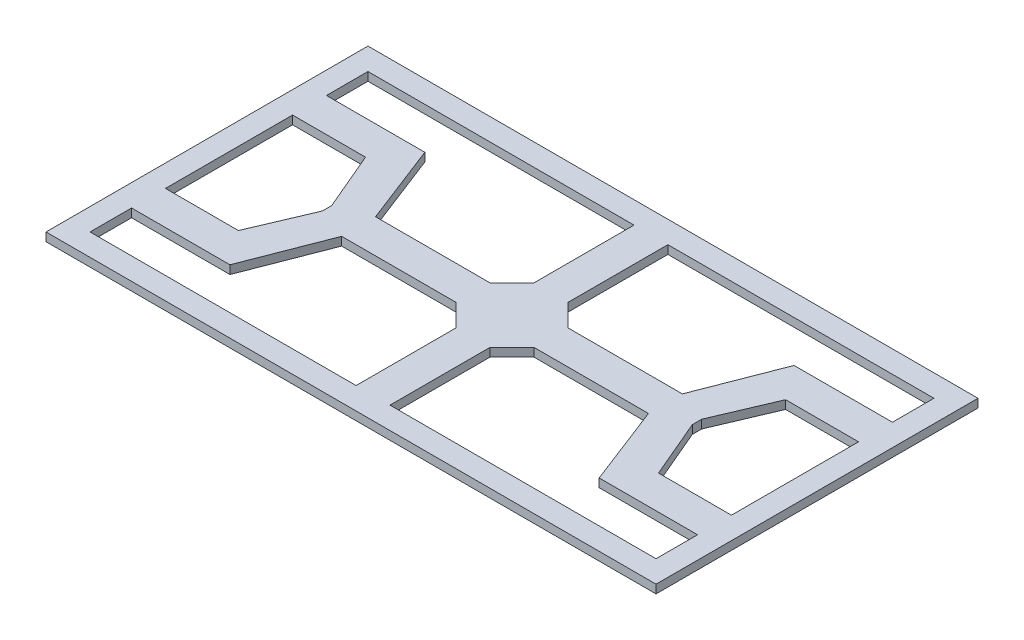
SolidWorks part; units mm, degrees
ref_plane "Front Plane" through (0, 0, 0) normal (0, 0, 1) x (1, 0, 0)
ref_plane "Top Plane" through (0, 0, 0) normal (0, 1, 0) x (1, 0, 0)
ref_plane "Right Plane" through (0, 0, 0) normal (1, 0, 0) x (0, 0, -1)
sketch "Sketch2" plane through (0, 0, 0) normal (0, 1, 0) x (1, 0, 0)
  line L0 (0, 241.3) -> (0, -49758.7) construction
  line L1 (-457.2, -241.3) -> (457.2, -241.3) construction
  line L2 (-457.2, -241.3) -> (-457.2, 241.3) construction
  line L3 (-457.2, 241.3) -> (457.2, 241.3) construction
  line L4 (457.2, -241.3) -> (457.2, 241.3) construction
  line L5 (-457.2, -241.3) -> (457.2, 241.3) construction
  line L6 (-457.2, 241.3) -> (457.2, -241.3) construction
  line L7 (-25.4, 58.1987) -> (-58.1987, 25.4)
  line L8 (-58.1987, -25.4) -> (-25.4, -58.1987)
  line L9 (25.4, -58.1987) -> (58.1987, -25.4)
  line L10 (58.1987, 25.4) -> (25.4, 58.1987)
  line L11 (0, 0) -> (50000, 0) construction
  line L13 (25.4, 208.28) -> (25.4, 58.1987)
  line L14 (-25.4, 208.28) -> (-25.4, 58.1987)
  line L15 (-25.4, -208.28) -> (-25.4, -58.1987)
  line L16 (25.4, -208.28) -> (25.4, -58.1987)
  line L18 (-424.18, -95.25) -> (-424.18, 95.25)
  line L20 (-424.18, 146.05) -> (-276.7263, 146.05)
  line L21 (-424.18, 95.25) -> (-314.8263, 95.25)
  line L22 (-229.9486, -25.4) -> (-229.9486, 25.4) construction
  line L23 (-276.7263, 146.05) -> (-229.9486, 25.4)
  line L24 (-229.9486, 25.4) -> (-277.3132, 7.0361) construction
  line L26 (-314.8263, 95.25) -> (-277.3132, 7.0361)
  line L28 (-229.9486, 25.4) -> (-58.1987, 25.4)
  line L29 (-277.3132, -7.0361) -> (-277.3132, 7.0361) construction
  line L30 (-277.3132, -7.0361) -> (-277.3132, 7.0361)
  line L31 (-229.9486, -25.4) -> (-58.1987, -25.4)
  line L32 (-229.9486, -25.4) -> (-277.3132, -7.0361) construction
  line L68 (-457.2, -241.3) -> (-457.2, 241.3)
  line L69 (-424.18, 146.05) -> (-424.18, 208.28)
  line L70 (-424.18, 208.28) -> (-25.4, 208.28)
  line L71 (-457.2, 241.3) -> (457.2, 241.3)
  line L72 (-424.18, -146.05) -> (-424.18, -208.28)
  line L73 (-424.18, -146.05) -> (-276.7263, -146.05)
  line L74 (-457.2, -241.3) -> (457.2, -241.3)
  line L75 (-424.18, -208.28) -> (-25.4, -208.28)
  line L78 (-276.7263, -146.05) -> (-229.9486, -25.4)
  line L80 (-314.8263, -95.25) -> (-277.3132, -7.0361)
  line L81 (-424.18, -95.25) -> (-314.8263, -95.25)
  line L82 (277.3132, -7.0361) -> (277.3132, 7.0361)
  line L85 (424.18, -208.28) -> (25.4, -208.28)
  line L86 (424.18, -146.05) -> (424.18, -208.28)
  line L87 (424.18, -146.05) -> (276.7263, -146.05)
  line L88 (276.7263, -146.05) -> (229.9486, -25.4)
  line L89 (229.9486, -25.4) -> (58.1987, -25.4)
  line L90 (314.8263, 95.25) -> (277.3132, 7.0361)
  line L91 (314.8263, -95.25) -> (277.3132, -7.0361)
  line L92 (424.18, -95.25) -> (314.8263, -95.25)
  line L93 (424.18, -95.25) -> (424.18, 95.25)
  line L94 (424.18, 95.25) -> (314.8263, 95.25)
  line L95 (457.2, -241.3) -> (457.2, 241.3)
  line L96 (424.18, 146.05) -> (424.18, 208.28)
  line L97 (424.18, 146.05) -> (276.7263, 146.05)
  line L98 (276.7263, 146.05) -> (229.9486, 25.4)
  line L100 (229.9486, 25.4) -> (58.1987, 25.4)
  line L102 (424.18, 208.28) -> (25.4, 208.28)
  circle A0 centre (0, 0) radius 63.5 construction
  point P8 (-457.2, 0)
  point P12 (-740.5283, -11.062)
  point P16 (457.2, 0)
  point P19 (0, 241.3)
  point P23 (0, 241.3)
  point P28 (0, -241.3)
  point P31 (-457.2, 0)
  point P35 (-229.9486, 0)
  point P41 (-277.3132, 0)
  point P42 (-277.3132, 0)
  point P44 (0, 0)
  point P46 (-424.18, 0)
  point P50 (0, -241.3)
  point P68 (0, 241.3)
  point P69 (0, 0)
  point P70 (41.7287, -115.5015)
  point P71 (0, 0)
  point P72 (0, 0)
  point P73 (0, 0)
  dimension "D1" = 127
  dimension "D2" = 914.4
  dimension "D3" = 482.6
  dimension "D4" = 50.8
  dimension "D6" = 95.25
  dimension "D7" = 33.02
  dimension "D8" = 63.5
  dimension "D9" = 50.8
  dimension "D10" = 50.8
  dimension "D11" = 37.5131
  dimension "1.3" = 33.02
  dimension "D13" = 50.8
  dimension "D14" = 33.02
extrude "Boss-Extrude1" add sketch "Sketch2" along normal blind 12.7
